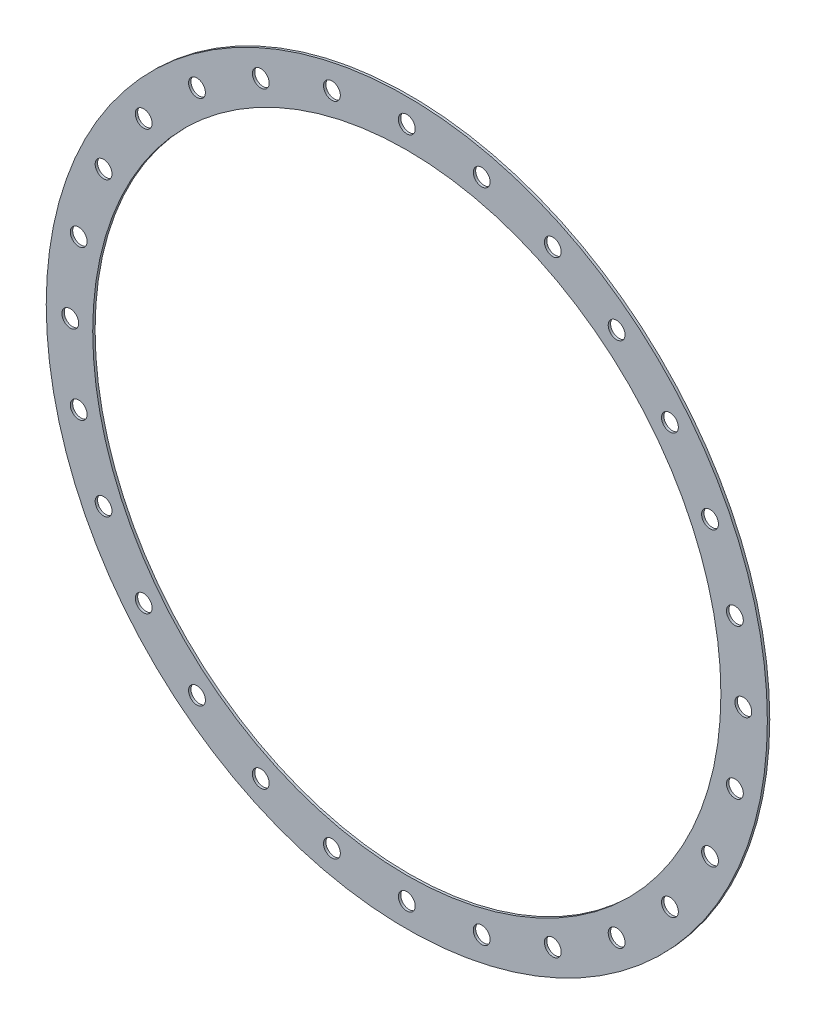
SolidWorks part; units mm, degrees
ref_plane "Alzado" through (0, 0, 0) normal (0, 0, 1) x (1, 0, 0)
ref_plane "Planta" through (0, 0, 0) normal (0, 1, 0) x (1, 0, 0)
ref_plane "Vista lateral" through (0, 0, 0) normal (1, 0, 0) x (0, 0, -1)
sketch "Croquis1" plane through (0, 0, 0) normal (0, 0, 1) x (1, 0, 0)
  circle A0 centre (0, 0) radius 196
  circle A1 centre (0, 0) radius 225
  dimension "D1" = 392
  dimension "D2" = 450
extrude "Saliente-Extruir1" add sketch "Croquis1" along normal blind 1.5
sketch "Croquis2" plane through (0, 0, 1.5) normal (0, 0, 1) x (1, 0, 0)
  line L0 (0, 0) -> (0, 210) construction
  circle A1 centre (0, 210) radius 5.25
  dimension "D2" = 10.5
  dimension "D1" = 210
extrude "Cortar-Extruir1" cut sketch "Croquis2" against normal blind 1.5
pattern_circular "MatrizC1" count 28 over 360 about axis through (0, 0, 0) along (0, 0, 1) of "Cortar-Extruir1"
